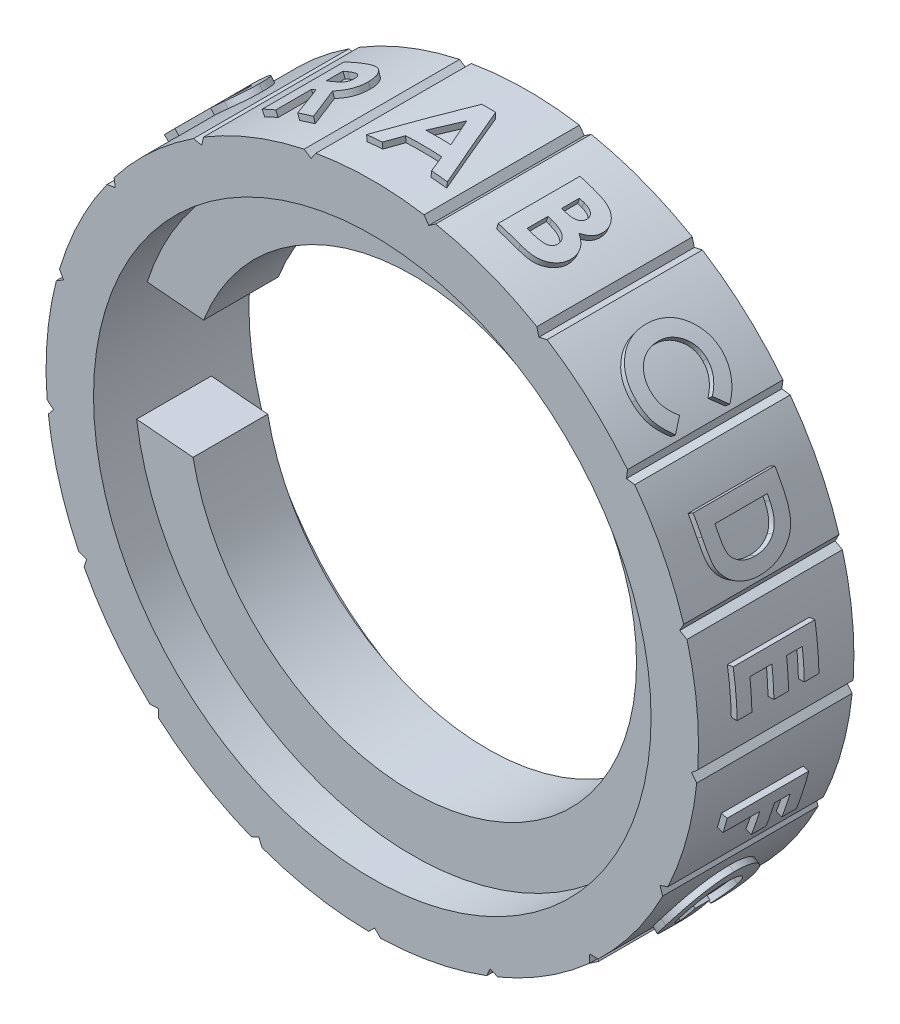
SolidWorks part; units mm, degrees
ref_plane "Front Plane" through (0, 0, 0) normal (0, 0, 1) x (1, 0, 0)
ref_plane "Top Plane" through (0, 0, 0) normal (0, 1, 0) x (1, 0, 0)
ref_plane "Right Plane" through (0, 0, 0) normal (1, 0, 0) x (0, 0, -1)
sketch "Sketch1" plane through (0, 0, 0) normal (0, 0, 1) x (1, 0, 0)
  circle A0 centre (0, 0) radius 13.97
  circle A1 centre (0, 0) radius 11.938
  dimension "D1" = 27.94
  dimension "D2" = 23.876
extrude "Boss-Extrude1" add sketch "Sketch1" along normal mid plane 6.6548
sketch "Sketch2" plane through (0, 0, 0) normal (0, 0, 1) x (1, 0, 0)
  line L0 (0, 0) -> (0, 7.4928) construction
  line L1 (-2.667, 7.4928) -> (2.667, 7.4928)
  line L3 (-2.667, 7.4928) -> (2.667, 7.4928)
  line L4 (-2.667, 7.4928) -> (-2.667, 12.4168)
  line L5 (-2.667, 12.4168) -> (2.667, 12.4168)
  line L6 (2.667, 7.4928) -> (2.667, 12.4168)
  circle A0 centre (0, 0) radius 9.5885
  circle A1 centre (0, 0) radius 12.7
  dimension "D1" = 19.177
  dimension "D4" = 25.4
  dimension "D2" = 5.334
  dimension "D3" = 4.924
extrude "Boss-Extrude2" add sketch "Sketch2" along normal mid plane 3.2004 contours L4 A1 L6 A0 | A0 L6 L5 L4
sketch "Sketch3" plane through (0, 0, 0) normal (0, 1, 0) x (1, 0, 0)
  text T0 "<b>A   B    C   D   E     F   G   H    I     J     K    L   M  N   O   P    R </b>" font "Century Gothic" height 3.5
wrap "Wrap1" sketch "Sketch3" wrap type emboss source sketch "Sketch3" thickness 0.254 parameters "D1"=0.254
sketch "Sketch4" plane through (0, 0, 0) normal (0, 0, 1) x (1, 0, 0)
  line L0 (0, 0) -> (-2.667, 13.7131) construction
  line L1 (-2.667, 13.7131) -> (2.667, 13.7131) construction
  line L2 (2.667, 13.7131) -> (0, 0) construction
  line L3 (-2.6185, 13.4637) -> (-2.9159, 13.6623)
  line L4 (-2.6185, 13.4637) -> (-2.4172, 13.7593)
  circle A0 centre (0, 0) radius 13.97 construction
  circle A1 centre (0, 0) radius 13.97
  dimension "D1" = 0.508
  dimension "D2" = 0.254
extrude "Cut-Extrude1" cut sketch "Sketch4" against normal mid plane 42.2148 contours L4 A1 L3
pattern_circular "CirPattern1" count 17 over 360 about axis through (0, 0, 0) along (0, 0, 1) of "Cut-Extrude1"
sketch "Sketch5" plane through (0, 0, 0) normal (0, 0, 1) x (1, 0, 0)
  line L0 (0.2267, 2.6573) -> (-0.2267, -2.6573)
  line L1 (-0.2267, -2.6573) -> (-11.8209, -1.6682)
  line L2 (0, 0) -> (-13.4337, 1.1461) construction
  line L3 (0.2267, 2.6573) -> (-11.3674, 3.6465)
  line L4 (-13.2194, 3.6573) -> (-13.6479, -1.3651)
  line L5 (-13.4337, 1.1461) -> (0, 0) construction
  circle A0 centre (0, 0) radius 11.938
  circle A1 centre (0, 0) radius 11.938 construction
  dimension "D2" = 5.334
  dimension "D1" = 5.334
  dimension "D3" = 11.6363
extrude "Cut-Extrude2" cut sketch "Sketch5" against normal mid plane 17.78 contours L3 A0 L1 L0
